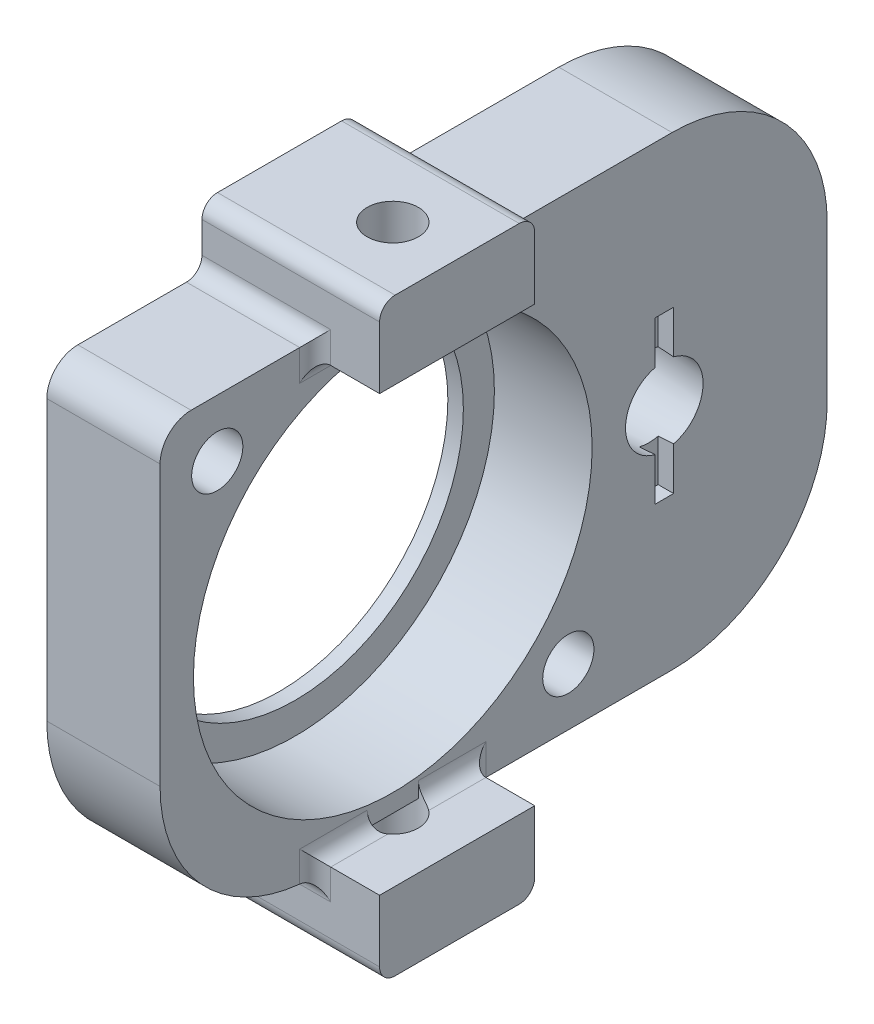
SolidWorks part; units mm, degrees
ref_plane "Front Plane" through (0, 0, 0) normal (1, 0, 0) x (0, 1, 0)
ref_plane "Top Plane" through (0, 0, 0) normal (0, 0, 1) x (0, 1, 0)
ref_plane "Right Plane" through (0, 0, 0) normal (0, 1, 0) x (-1, 0, 0)
sketch "Sketch1" plane through (0, 0, 0) normal (1, 0, 0) x (0, 1, 0)
  line L0 (-15, 15) -> (-15, 5)
  line L1 (-15, -28) -> (15, -28)
  line L2 (15, -28) -> (15, -5)
  line L3 (-15, 15) -> (15, 15)
  line L4 (0, 0) -> (0, 15) construction
  line L5 (0, 0) -> (-15, 0) construction
  line L7 (15, 5) -> (19, 5)
  line L8 (19, 5) -> (19, -5)
  line L9 (19, -5) -> (15, -5)
  line L10 (15, 5) -> (15, 15)
  line L11 (-19, -5) -> (-15, -5)
  line L12 (-19, 5) -> (-19, -5)
  line L13 (-15, 5) -> (-19, 5)
  line L14 (-15, -5) -> (-15, -28)
  line L15 (-11.3137, -11.3137) -> (11.3137, 11.3137) construction
  circle A0 centre (0, 0) radius 10.85
  circle A1 centre (0, -17.5) radius 2.5
  circle A2 centre (11.3137, 11.3137) radius 1.65
  circle A3 centre (-11.3137, -11.3137) radius 1.65
  point P7 (0, -28)
  point P17 (19, 0)
  point P28 (0, 0)
  dimension "D1" = 21.7
  dimension "D6" = 5
  dimension "D7" = 45
  dimension "D4" = 3.3
  dimension "D2" = 15
  dimension "D3" = 17.5
  dimension "D5" = 28
  dimension "D8" = 16
  dimension "D10" = 10
  dimension "D11" = 4
extrude "Boss-Extrude1" add sketch "Sketch1" along normal blind 1
sketch "Sketch2" plane through (1, 0, 0) normal (1, 0, 0) x (0, 1, 0)
  line L5 (15, 5) -> (19, 5)
  line L6 (19, 5) -> (19, -5)
  line L7 (19, -5) -> (15, -5)
  line L8 (15, -5) -> (15, -28)
  line L14 (15, 15) -> (15, 5)
  line L15 (15, 15) -> (-15, 15)
  line L16 (-15, 15) -> (-15, 5)
  line L17 (-15, 5) -> (-19, 5)
  line L18 (-19, 5) -> (-19, -5)
  line L19 (-19, -5) -> (-15, -5)
  line L20 (-15, -5) -> (-15, -28)
  line L21 (-15, -28) -> (15, -28)
  line L22 (15, 5) -> (15, 15) construction
  circle A0 centre (0, 0) radius 12.85
  circle A1 centre (0, -17.5) radius 2.5
  circle A3 centre (0, -17.5) radius 2.5 construction
  circle A4 centre (11.3137, 11.3137) radius 1.65
  circle A5 centre (-11.3137, -11.3137) radius 1.65
  circle A6 centre (-11.3137, -11.3137) radius 1.65 construction
  circle A7 centre (11.3137, 11.3137) radius 1.65 construction
  dimension "D1" = 25.7
extrude "Boss-Extrude2" add sketch "Sketch2" along normal blind 6.3
sketch "Sketch3" plane through (7.3, 0, 0) normal (1, 0, 0) x (0, 1, 0)
  line L0 (19, -5) -> (19, 5)
  line L1 (19, 5) -> (14, 5)
  line L2 (14, 5) -> (14, -5)
  line L3 (14, -5) -> (19, -5)
  line L4 (0, 0) -> (0, 15) construction
  line L5 (15, 15) -> (-15, 15) construction
  line L6 (-14, -5) -> (-19, -5)
  line L7 (-14, 5) -> (-14, -5)
  line L8 (-19, -5) -> (-19, 5)
  line L9 (-19, 5) -> (-14, 5)
  dimension "D1" = 1
extrude "Boss-Extrude3" add sketch "Sketch3" along normal blind 4.15
sketch "Sketch8" plane through (0, -19, 0) normal (0, -1, 0) x (1, 0, 0)
  line L0 (7.3, 15) -> (7.3, 5) construction
  circle A0 centre (7.3, 0) radius 1.65
  dimension "D1" = 3.3
extrude "Cut-Extrude3" cut sketch "Sketch8" against normal blind 5
mirror "Mirror1" about plane through (0, 0, 0) normal (0, 1, 0) of "Cut-Extrude3"
sketch "Sketch9" plane through (7.3, 0, 0) normal (1, 0, 0) x (0, 1, 0)
  line L0 (-5.2, -17.5) -> (5.2, -17.5) construction
  line L1 (-15, -28) -> (15, -28) construction
  line L2 (-5.2, -16.9) -> (5.2, -16.9)
  line L3 (-5.2, -16.9) -> (-5.2, -18.1)
  line L4 (-5.2, -18.1) -> (5.2, -18.1)
  line L5 (5.2, -16.9) -> (5.2, -18.1)
  circle A0 centre (0, -17.5) radius 2.5 construction
  point P4 (0, -17.5)
  point P9 (-5.2, -17.5)
  point P10 (0, -16.9)
  dimension "D1" = 1.2
  dimension "D2" = 10.4
extrude "Cut-Extrude2" cut sketch "Sketch9" against normal blind 1
sketch "Sketch10" plane through (0, 0, 0) normal (-1, 0, 0) x (0, -1, 0)
  line L1 (-8.1349, 10.462) -> (-8.9867, 13.6407)
  line L2 (-8.9867, 13.6407) -> (-12.1655, 14.4925)
  line L3 (-12.1655, 14.4925) -> (-14.4925, 12.1655)
  line L4 (-14.4925, 12.1655) -> (-13.6407, 8.9867)
  line L5 (-13.6407, 8.9867) -> (-10.462, 8.1349)
  line L6 (-10.462, 8.1349) -> (-8.1349, 10.462)
  line L7 (12.1655, -14.4925) -> (14.4925, -12.1655)
  line L8 (14.4925, -12.1655) -> (13.6407, -8.9867)
  line L9 (13.6407, -8.9867) -> (10.462, -8.1349)
  line L10 (10.462, -8.1349) -> (8.1349, -10.462)
  line L11 (8.1349, -10.462) -> (8.9867, -13.6407)
  line L12 (8.9867, -13.6407) -> (12.1655, -14.4925)
  line L13 (-14.4925, 12.1655) -> (-15, 12.1655) construction
  line L14 (-15, 5) -> (-15, 15) construction
  line L15 (-12.1655, 14.4925) -> (-12.1655, 15) construction
  line L16 (-15, 15) -> (15, 15) construction
  circle A0 centre (-11.3137, 11.3137) radius 2.85 construction
  circle A1 centre (11.3137, -11.3137) radius 2.85 construction
  dimension "D1" = 5.7
extrude "Cut-Extrude4" cut sketch "Sketch10" against normal blind 3.6
fillet "Fillet2" radius 10 3 edges at (3.65, 15, -28) (3.65, -15, -28) (3.65, -15, 15)
fillet "Fillet3" radius 1 16 edges at (5.725, 19, 5) (3.65, 15, 5) (5.725, 19, -5) (3.65, 15, -5) (3.65, -15, -5) (5.725, -19, -5) (5.725, -19, 5) (7.3, 14.5, 5) (7.3, 14.5, -5) (7.3, -14.5, -5) (7.3, -14.5, 5) (7.3, -14, -3.325) (7.3, -14, 3.325) (7.3, 14, -3.325) (7.3, 14, 3.325) (3.65, -15, 5)
fillet "Fillet4" radius 2 1 edges at (3.65, 15, 15)
chamfer "Chamfer2" distance 7.3 distance2 0.5 1 edges at (0, 0, -20)
